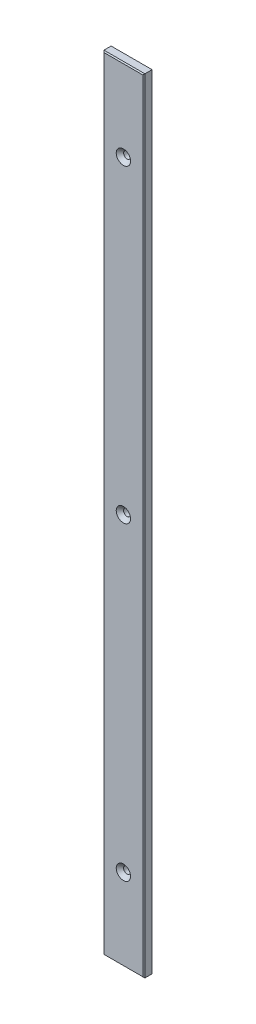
SolidWorks part; units mm, degrees
ref_plane "Ebene vorne" through (0, 0, 0) normal (0, 0, 1) x (1, 0, 0)
ref_plane "Ebene oben" through (0, 0, 0) normal (0, 1, 0) x (1, 0, 0)
ref_plane "Ebene rechts" through (0, 0, 0) normal (1, 0, 0) x (0, 0, -1)
sketch "Skizze1" plane through (0, 0, 0) normal (0, 0, 1) x (1, 0, 0)
  line L1 (-10, -191.25) -> (10, -191.25)
  line L2 (-10, -191.25) -> (-10, 191.25)
  line L3 (-10, 191.25) -> (10, 191.25)
  line L4 (10, -191.25) -> (10, 191.25)
  line L5 (-10, -191.25) -> (10, 191.25) construction
  line L6 (-10, 191.25) -> (10, -191.25) construction
  point P0 (0, 0)
  dimension "D1" = 382.5
  dimension "D2" = 20
extrude "Aufsatz-Linear austragen1" add sketch "Skizze1" along normal blind 4
hole_wizard "Formsenkung für M3 Senkschraube mit Innensechskant1" positions "Skizze2" profile "Skizze3" countersink size "M3" standard "DIN"
sketch "Skizze2" plane through (0, 0, 4) normal (0, 0, 1) x (1, 0, 0)
  line L0 (10, 191.25) -> (-10, 191.25) construction
  line L1 (-10, -191.25) -> (10, -191.25) construction
  point P0 (0, 151.25)
  point P2 (0, 0)
  point P5 (0, -151.25)
  dimension "D1" = 40
  dimension "D2" = 40
sketch "Skizze3" plane through (0, 151.25, 4) normal (1, 0, 0) x (0, -1, 0)
  line L0 (0, 0) -> (0, 4)
  line L1 (0, 4) -> (1.7, 4)
  line L2 (1.7, 4) -> (1.7, 1.8)
  line L3 (1.7, 1.8) -> (3.5, 0)
  line L5 (3.5, 0) -> (0, 0)
  line L6 (-1.7, 1.8) -> (-3.5, 0) construction
  line L11 (0, -6.35) -> (0, 107.95) construction
  dimension "Bohrerdurchmesser" = 3.4
  dimension "Bohrungstiefe" = 4
  dimension "Senkdurchmesser (Oben)" = 7
  dimension "Senkwinkel (Oben)" = 90
chamfer "Fase1" distance 0.5 angle 45 4 edges at (0, -191.25, 4) (10, 0, 4) (-10, 0, 4) (0, 191.25, 4)
